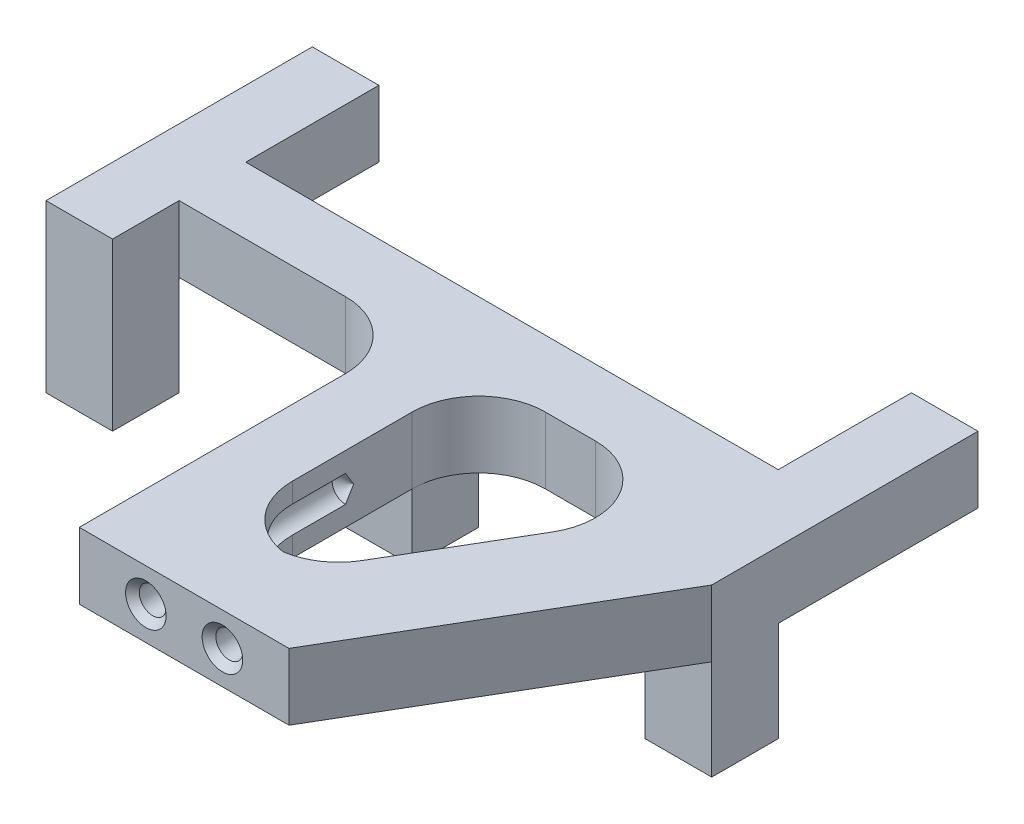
SolidWorks part; units mm, degrees
ref_plane "Front Plane" through (0, 0, 0) normal (0, 0, 1) x (1, 0, 0)
ref_plane "Top Plane" through (0, 0, 0) normal (0, 1, 0) x (1, 0, 0)
ref_plane "Right Plane" through (0, 0, 0) normal (1, 0, 0) x (0, 0, -1)
sketch "Sketch1" plane through (0, 0, 0) normal (0, 0, 1) x (1, 0, 0)
  line L1 (0, 0) -> (10, 0)
  line L2 (0, 0) -> (0, 10)
  line L3 (0, 10) -> (10, 10)
  line L4 (10, 0) -> (10, 10)
  line L5 (0, 0) -> (10, 10) construction
  line L6 (0, 10) -> (10, 0) construction
  point P4 (5, 5)
  dimension "D1" = 10
extrude "Boss-Extrude1" add sketch "Sketch1" along normal blind 50 contours L2 L3 L4 L1
ref_plane "Midplane" through (5, 0, 0) normal (1, 0, 0) x (0, 0, -1)
sketch "Sketch2" plane through (5, 0, 0) normal (1, 0, 0) x (0, 0, -1)
  line L1 (0, 10) -> (10, 10)
  line L2 (0, 10) -> (0, 0)
  line L3 (0, 0) -> (10, 0)
  line L4 (10, 10) -> (10, 0)
  line L5 (0, 10) -> (10, 0) construction
  line L6 (0, 0) -> (10, 10) construction
  point P4 (5, 5)
  dimension "D1" = 10
extrude "Boss-Extrude2" add sketch "Sketch2" along normal mid plane 100
sketch "Sketch3" plane through (0, 0, 0) normal (0, -1, 0) x (1, 0, 0)
  line L0 (10, 50) -> (10, 0) construction
  line L1 (0, 0) -> (10, 0)
  line L2 (0, 0) -> (0, 10)
  line L3 (0, 10) -> (10, 10)
  line L4 (10, 0) -> (10, 10)
  line L5 (0, 0) -> (10, 10) construction
  line L6 (0, 10) -> (10, 0) construction
  point P4 (5, 5)
  dimension "D1" = 10
extrude "Boss-Extrude3" add sketch "Sketch3" along normal blind 10
sketch "Sketch4" plane through (0, 10, 0) normal (0, 1, 0) x (1, 0, 0)
  line L0 (0, 0) -> (-45, 0) construction
  line L1 (-45, 0) -> (-35, 0)
  line L2 (-45, 0) -> (-45, -10)
  line L3 (-45, -10) -> (-35, -10)
  line L4 (-35, 0) -> (-35, -10)
  line L5 (-45, 0) -> (-35, -10) construction
  line L6 (-45, -10) -> (-35, 0) construction
  line L7 (-45, 10) -> (-45, 0) construction
  point P4 (-40, -5)
  dimension "D1" = 10
extrude "Boss-Extrude4" add sketch "Sketch4" against normal blind 25
mirror "Mirror1" about plane through (5, 0, 0) normal (1, 0, 0) of "Boss-Extrude4"
sketch "Sketch5" plane through (0, 0, -10) normal (0, 0, -1) x (-1, 0, 0)
  line L0 (-55, 0) -> (45, 0) construction
  line L1 (-55, 10) -> (-45, 10)
  line L2 (-55, 10) -> (-55, 0)
  line L3 (-55, 0) -> (-45, 0)
  line L4 (-45, 10) -> (-45, 0)
  line L5 (-55, 10) -> (-45, 0) construction
  line L6 (-55, 0) -> (-45, 10) construction
  point P4 (-50, 5)
extrude "Boss-Extrude5" add sketch "Sketch5" along normal blind 20
mirror "Mirror2" about plane through (5, 0, 0) normal (1, 0, 0) of "Boss-Extrude5"
sketch "Sketch7" plane through (0, 0, 50) normal (0, 0, 1) x (1, 0, 0)
  line L0 (0, 0) -> (10, 0) construction
  line L1 (10, 10) -> (31.5, 10)
  line L2 (10, 10) -> (10, 0)
  line L3 (10, 0) -> (31.5, 0)
  line L4 (31.5, 10) -> (31.5, 0)
  line L5 (10, 10) -> (31.5, 0) construction
  line L6 (10, 0) -> (31.5, 10) construction
  line L7 (0, 0) -> (0, 10) construction
  point P4 (20.75, 5)
  dimension "D1" = 31.5
extrude "Boss-Extrude6" add sketch "Sketch7" against normal blind 12
ref_plane "Plane2" through (0, 5, 0) normal (0, -1, 0) x (-1, 0, 0)
sketch "Sketch12" plane through (0, 10, 0) normal (0, 1, 0) x (1, 0, 0)
  line L0 (31.5, -50) -> (55, -10)
  line L1 (22.675, -38) -> (45, 0)
  line L2 (31.5, -38) -> (10, -38) construction
  line L4 (22.675, -38) -> (31.5, -50)
  line L5 (45, 0) -> (55, -10)
  point P8 (38.632, -7.5626)
  point P9 (45, 0)
  point P10 (20.75, -38)
  point P11 (45, 3.2766)
extrude "Boss-Extrude7" add sketch "Sketch12" against normal up to surface (10 mm away)
fillet "Fillet1" radius 10 5 edges at (45, 5, 0) (22.675, 5, 38) (10, 5, 38) (10, 5, 0) (0, 5, 0)
hole_wizard "#10-32 Tapped Hole1" positions "Sketch8" profile "Sketch10" tap size "#10-32" standard "ANSI Inch"
sketch "Sketch8" plane through (0, 0, 50) normal (0, 0, 1) x (1, 0, 0)
  point P0 (10, 5)
  point P3 (21.5, 5)
sketch "Sketch10" plane through (10, 5, 50) normal (1, 0, 0) x (0, -1, 0)
  line L0 (0, 0) -> (0, 31.2133)
  line L1 (0, 31.2133) -> (2.0193, 30)
  line L2 (2.0193, 30) -> (2.0193, 1.0287)
  line L3 (2.0193, 1.0287) -> (3.048, 0)
  line L5 (3.048, 0) -> (0, 0)
  line L6 (-2.0193, 1.0287) -> (-3.048, 0) construction
  line L10 (0, 31.2133) -> (-2.0193, 30) construction
  line L11 (0, -6.35) -> (0, 107.95) construction
  dimension "Tap Drill Dia." = 4.0386
  dimension "Tap Drill Depth" = 30
  dimension "Near C'Sink Dia." = 6.096
  dimension "Near C'Sink Angle" = 90
  dimension "Drill Angle" = 118
